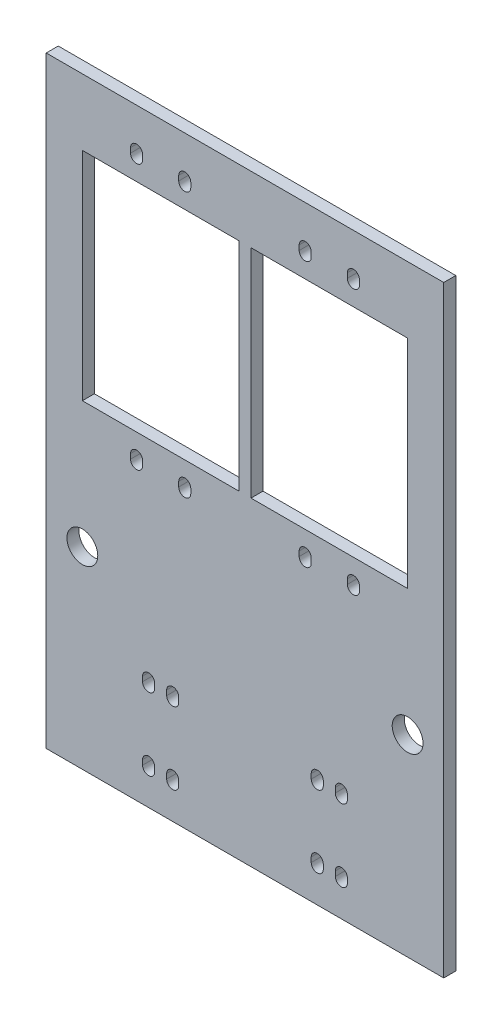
SolidWorks part; units mm, degrees
ref_plane "Front Plane" through (0, 0, 0) normal (0, 0, 1) x (1, 0, 0)
ref_plane "Top Plane" through (0, 0, 0) normal (0, 1, 0) x (1, 0, 0)
ref_plane "Right Plane" through (0, 0, 0) normal (1, 0, 0) x (0, 0, -1)
sketch "Sketch1" plane through (0, 0, 0) normal (0, 0, 1) x (1, 0, 0)
  line L1 (-104.775, 158.75) -> (104.775, 158.75)
  line L2 (-104.775, 158.75) -> (-104.775, -158.75)
  line L3 (-104.775, -158.75) -> (104.775, -158.75)
  line L4 (104.775, 158.75) -> (104.775, -158.75)
  line L5 (-104.775, 158.75) -> (104.775, -158.75) construction
  line L6 (-104.775, -158.75) -> (104.775, 158.75) construction
  point P0 (0, 0)
  dimension "D1" = 209.55
  dimension "D2" = 317.5
extrude "Boss-Extrude1" add sketch "Sketch1" along normal blind 6.35
sketch "Sketch2" plane through (0, 0, 6.35) normal (0, 0, 1) x (1, 0, 0)
  line L0 (0, 158.75) -> (0, -158.75) construction
  line L1 (-104.775, -158.75) -> (104.775, -158.75) construction
  line L2 (-85.725, 158.75) -> (-85.725, -158.75) construction
  line L3 (104.775, 158.75) -> (-104.775, 158.75) construction
  line L4 (-104.775, 158.75) -> (-104.775, -158.75) construction
  line L5 (-44.45, -139.7) -> (44.45, -139.7) construction
  line L6 (-50.8, -102.87) -> (-50.8, -100.33) construction
  line L7 (-38.1, -139.7) -> (-50.8, -139.7) construction
  line L8 (38.1, -139.7) -> (50.8, -139.7)
  line L9 (-44.45, -139.7) -> (-44.45, -101.6) construction
  line L10 (44.45, -139.7) -> (44.45, -101.6) construction
  line L11 (-50.8, -101.6) -> (-38.1, -101.6) construction
  line L12 (-53.975, -102.87) -> (-53.975, -100.33)
  line L13 (-47.625, -102.87) -> (-47.625, -100.33)
  line L14 (-38.1, -102.87) -> (-38.1, -100.33) construction
  line L15 (-34.925, -102.87) -> (-34.925, -100.33)
  line L16 (-41.275, -102.87) -> (-41.275, -100.33)
  line L17 (-44.45, -120.65) -> (-39.3755, -120.65) construction
  line L18 (-38.1, -138.43) -> (-38.1, -140.97) construction
  line L19 (-34.925, -138.43) -> (-34.925, -140.97)
  line L20 (-41.275, -138.43) -> (-41.275, -140.97)
  line L21 (-50.8, -138.43) -> (-50.8, -140.97) construction
  line L22 (-53.975, -138.43) -> (-53.975, -140.97)
  line L23 (-47.625, -138.43) -> (-47.625, -140.97)
  line L24 (50.8, -138.43) -> (50.8, -140.97) construction
  line L25 (53.975, -138.43) -> (53.975, -140.97)
  line L26 (47.625, -138.43) -> (47.625, -140.97)
  line L27 (38.1, -138.43) -> (38.1, -140.97) construction
  line L28 (34.925, -138.43) -> (34.925, -140.97)
  line L29 (41.275, -138.43) -> (41.275, -140.97)
  line L30 (38.1, -102.87) -> (38.1, -100.33) construction
  line L31 (34.925, -102.87) -> (34.925, -100.33)
  line L32 (41.275, -102.87) -> (41.275, -100.33)
  line L33 (50.8, -102.87) -> (50.8, -100.33) construction
  line L34 (53.975, -102.87) -> (53.975, -100.33)
  line L35 (47.625, -102.87) -> (47.625, -100.33)
  line L36 (-44.45, -101.6) -> (-44.45, 158.75) construction
  line L37 (44.45, -101.6) -> (44.45, 158.75) construction
  line L38 (-44.45, -120.65) -> (-44.45, 9.525) construction
  line L39 (-85.725, 9.525) -> (-3.175, 9.525)
  line L40 (-85.725, 9.525) -> (-85.725, 123.825)
  line L41 (-85.725, 123.825) -> (-3.175, 123.825)
  line L42 (-3.175, 123.825) -> (-3.175, 9.525)
  line L43 (-44.45, 136.525) -> (-31.75, 136.525) construction
  line L44 (-85.725, 66.675) -> (-44.45, 66.675) construction
  line L45 (-31.75, 137.795) -> (-31.75, 135.255) construction
  line L46 (-28.575, 137.795) -> (-28.575, 135.255)
  line L47 (-34.925, 137.795) -> (-34.925, 135.255)
  line L48 (-57.15, 137.795) -> (-57.15, 135.255) construction
  line L49 (-60.325, 137.795) -> (-60.325, 135.255)
  line L50 (-53.975, 137.795) -> (-53.975, 135.255)
  line L51 (-31.75, -4.445) -> (-31.75, -1.905) construction
  line L52 (-28.575, -4.445) -> (-28.575, -1.905)
  line L53 (-34.925, -4.445) -> (-34.925, -1.905)
  line L54 (-57.15, -4.445) -> (-57.15, -1.905) construction
  line L55 (-60.325, -4.445) -> (-60.325, -1.905)
  line L56 (-53.975, -4.445) -> (-53.975, -1.905)
  line L57 (31.75, -4.445) -> (31.75, -1.905) construction
  line L58 (28.575, -4.445) -> (28.575, -1.905)
  line L59 (34.925, -4.445) -> (34.925, -1.905)
  line L60 (57.15, -4.445) -> (57.15, -1.905) construction
  line L61 (60.325, -4.445) -> (60.325, -1.905)
  line L62 (53.975, -4.445) -> (53.975, -1.905)
  line L63 (85.725, 9.525) -> (3.175, 9.525)
  line L64 (3.175, 123.825) -> (3.175, 9.525)
  line L65 (85.725, 123.825) -> (3.175, 123.825)
  line L66 (85.725, 9.525) -> (85.725, 123.825)
  line L67 (31.75, 137.795) -> (31.75, 135.255) construction
  line L68 (28.575, 137.795) -> (28.575, 135.255)
  line L69 (34.925, 137.795) -> (34.925, 135.255)
  line L70 (57.15, 137.795) -> (57.15, 135.255) construction
  line L71 (60.325, 137.795) -> (60.325, 135.255)
  line L72 (53.975, 137.795) -> (53.975, 135.255)
  circle A1 centre (-85.725, -57.15) radius 8.128
  circle A4 centre (85.725, -57.15) radius 8.128
  arc A6 (-53.975, -102.87) -> (-47.625, -102.87) centre (-50.8, -102.87) ccw
  arc A7 (-47.625, -100.33) -> (-53.975, -100.33) centre (-50.8, -100.33) ccw
  arc A8 (-34.925, -102.87) -> (-41.275, -102.87) centre (-38.1, -102.87) cw
  arc A9 (-41.275, -100.33) -> (-34.925, -100.33) centre (-38.1, -100.33) cw
  arc A10 (-34.925, -138.43) -> (-41.275, -138.43) centre (-38.1, -138.43) ccw
  arc A11 (-41.275, -140.97) -> (-34.925, -140.97) centre (-38.1, -140.97) ccw
  arc A12 (-53.975, -138.43) -> (-47.625, -138.43) centre (-50.8, -138.43) cw
  arc A13 (-47.625, -140.97) -> (-53.975, -140.97) centre (-50.8, -140.97) cw
  arc A14 (53.975, -138.43) -> (47.625, -138.43) centre (50.8, -138.43) ccw
  arc A15 (47.625, -140.97) -> (53.975, -140.97) centre (50.8, -140.97) ccw
  arc A16 (34.925, -138.43) -> (41.275, -138.43) centre (38.1, -138.43) cw
  arc A17 (41.275, -140.97) -> (34.925, -140.97) centre (38.1, -140.97) cw
  arc A18 (34.925, -102.87) -> (41.275, -102.87) centre (38.1, -102.87) ccw
  arc A19 (41.275, -100.33) -> (34.925, -100.33) centre (38.1, -100.33) ccw
  arc A20 (53.975, -102.87) -> (47.625, -102.87) centre (50.8, -102.87) cw
  arc A21 (47.625, -100.33) -> (53.975, -100.33) centre (50.8, -100.33) cw
  arc A23 (-28.575, 137.795) -> (-34.925, 137.795) centre (-31.75, 137.795) ccw
  arc A24 (-34.925, 135.255) -> (-28.575, 135.255) centre (-31.75, 135.255) ccw
  arc A25 (-60.325, 137.795) -> (-53.975, 137.795) centre (-57.15, 137.795) cw
  arc A26 (-53.975, 135.255) -> (-60.325, 135.255) centre (-57.15, 135.255) cw
  arc A27 (-28.575, -4.445) -> (-34.925, -4.445) centre (-31.75, -4.445) cw
  arc A28 (-34.925, -1.905) -> (-28.575, -1.905) centre (-31.75, -1.905) cw
  arc A29 (-60.325, -4.445) -> (-53.975, -4.445) centre (-57.15, -4.445) ccw
  arc A30 (-53.975, -1.905) -> (-60.325, -1.905) centre (-57.15, -1.905) ccw
  arc A31 (28.575, -4.445) -> (34.925, -4.445) centre (31.75, -4.445) ccw
  arc A32 (34.925, -1.905) -> (28.575, -1.905) centre (31.75, -1.905) ccw
  arc A33 (60.325, -4.445) -> (53.975, -4.445) centre (57.15, -4.445) cw
  arc A34 (53.975, -1.905) -> (60.325, -1.905) centre (57.15, -1.905) cw
  arc A35 (28.575, 137.795) -> (34.925, 137.795) centre (31.75, 137.795) cw
  arc A36 (34.925, 135.255) -> (28.575, 135.255) centre (31.75, 135.255) cw
  arc A37 (60.325, 137.795) -> (53.975, 137.795) centre (57.15, 137.795) ccw
  arc A38 (53.975, 135.255) -> (60.325, 135.255) centre (57.15, 135.255) ccw
  point P6 (0, 0)
  point P19 (-31.75, 136.525)
  point P28 (0, -139.7)
  point P31 (-44.45, -139.7)
  point P34 (44.45, -139.7)
  point P39 (-44.45, -101.6)
  point P40 (-50.8, -101.6)
  point P47 (-38.1, -101.6)
  point P56 (-38.1, -139.7)
  point P63 (-50.8, -139.7)
  point P70 (50.8, -139.7)
  point P77 (38.1, -139.7)
  point P84 (38.1, -101.6)
  point P91 (50.8, -101.6)
  point P102 (-44.45, 9.525)
  point P109 (-57.15, 136.525)
  point P116 (-31.75, -3.175)
  point P123 (-57.15, -3.175)
  point P130 (31.75, -3.175)
  point P137 (57.15, -3.175)
  point P148 (31.75, 136.525)
  point P155 (57.15, 136.525)
  dimension "D2" = 12.7
  dimension "D3" = 16.256
  dimension "D4" = 12.7
  dimension "D12" = 3.175
  dimension "D5" = 2.54
  dimension "D6" = 3.175
  dimension "D17" = 101.6
  dimension "D1" = 19.05
  dimension "D7" = 19.05
  dimension "D8" = 88.9
  dimension "D9" = 12.7
  dimension "D10" = 12.7
  dimension "D11" = 38.1
  dimension "D13" = 2.54
  dimension "D14" = 130.175
  dimension "D15" = 82.55
  dimension "D16" = 114.3
extrude "Cut-Extrude2" cut sketch "Sketch2" against normal blind 6.35
